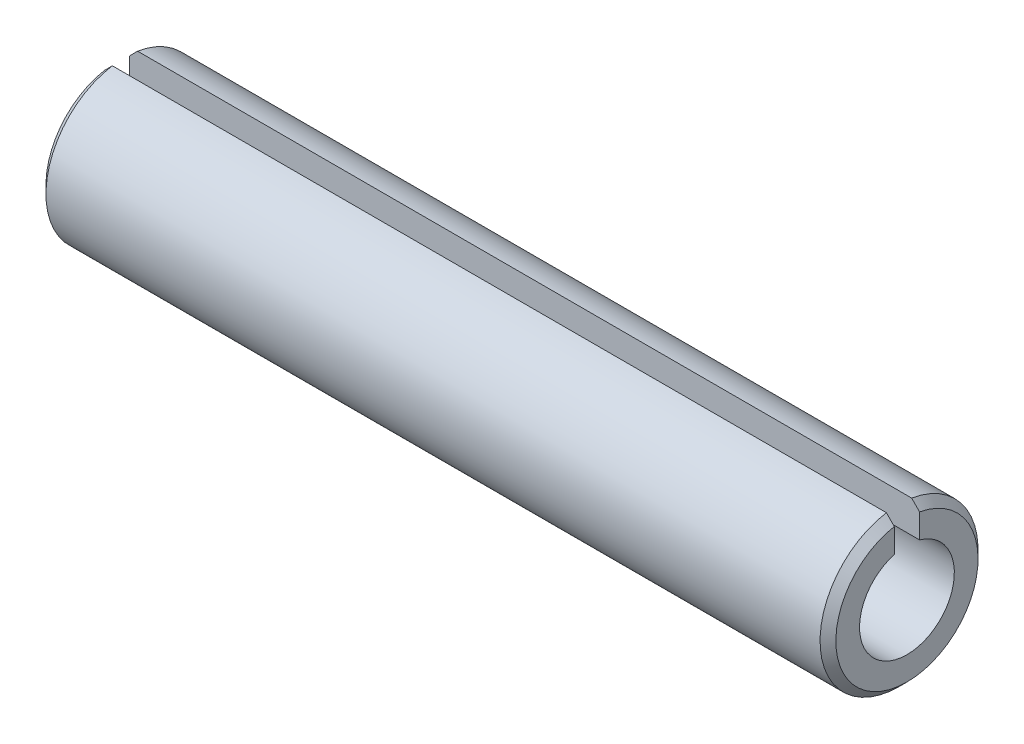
SolidWorks part; units mm, degrees
ref_plane "Plan1" through (0, 0, 0) normal (0, 0, 1) x (1, 0, 0)
ref_plane "Plan2" through (0, 0, 0) normal (0, 1, 0) x (1, 0, 0)
ref_plane "Plan3" through (0, 0, 0) normal (1, 0, 0) x (0, 0, -1)
sketch "Esquisse1" plane through (0, 0, 0) normal (0, 0, 1) x (1, 0, 0)
  line L0 (0, 3) -> (0, 4.5)
  line L1 (0, 3) -> (50, 3)
  line L2 (50, 3) -> (50, 4.5)
  line L3 (50, 4.5) -> (49.5, 5)
  line L4 (49.5, 5) -> (0.5, 5)
  line L5 (0.5, 5) -> (0, 4.5)
  line L6 (0, 0) -> (50, 0) construction
  point P11 (25, 0)
  dimension "D1" = 50
  dimension "D2" = 5
  dimension "D3" = 2
  dimension "D4" = 45
  dimension "D5" = 45
  dimension "D6" = 0.5
revolve "Base-Révolution" add sketch "Esquisse1" angle 360 about L6
sketch "Esquisse2" plane through (0, 0, 0) normal (1, 0, 0) x (0, 0, -1)
  line L0 (0, 0) -> (0, 5) construction
  line L1 (0.8, 4.9356) -> (0.8, 2.8914)
  line L2 (-0.8, 4.9356) -> (-0.8, 2.8914)
  circle A0 centre (0, 0) radius 5 construction
  circle A1 centre (0, 0) radius 3 construction
  arc A2 (0.8, 2.8914) -> (-0.8, 2.8914) centre (0, 0) ccw
  arc A3 (0.8, 4.9356) -> (-0.8, 4.9356) centre (0, 0) ccw
  dimension "D1" = 0.8
extrude "Enlèv. mat.-Extru.2" cut sketch "Esquisse2" along normal through all
equation "\"D6@Esquisse1\"=\"D2@Esquisse1\"/10"
equation "\"D1@Esquisse2\"=\"D3@Esquisse1\"/2.5"
